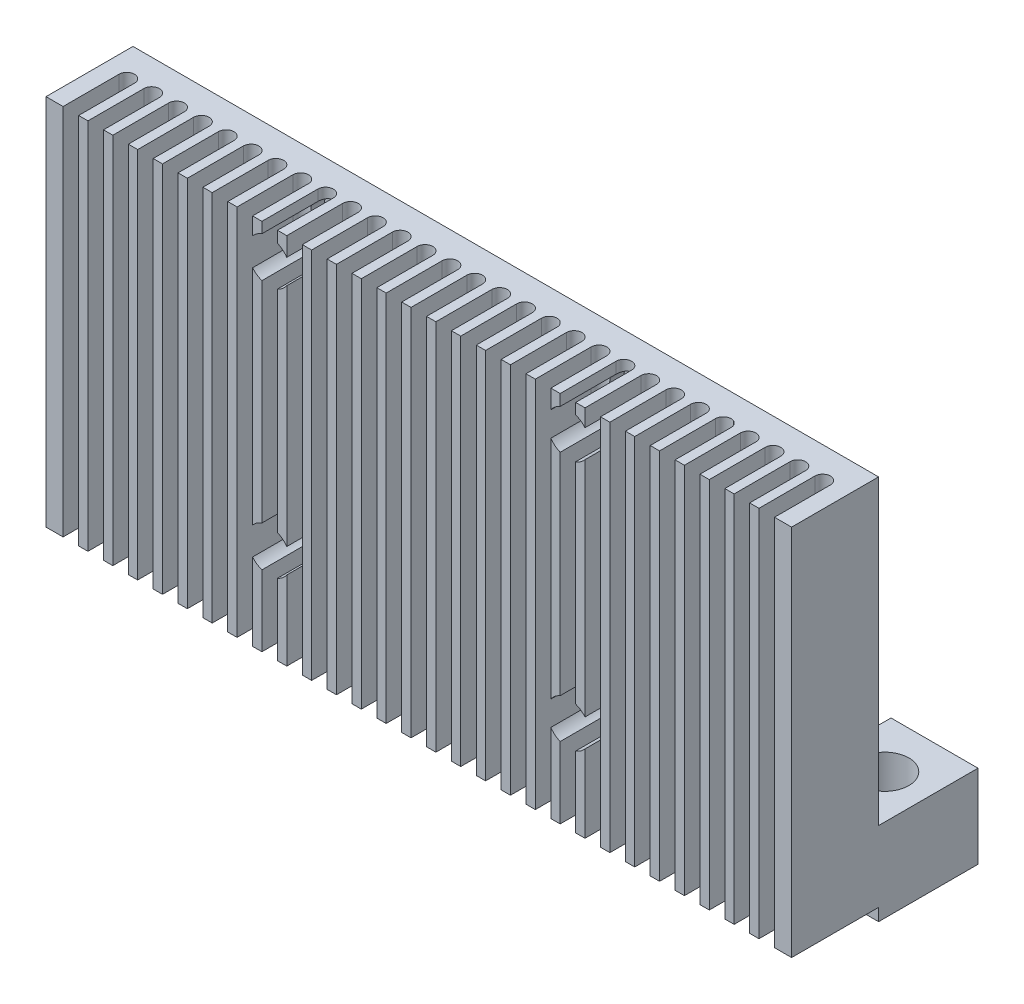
SolidWorks part; units mm, degrees
ref_plane "Front Plane" through (0, 0, 0) normal (0, 0, 1) x (1, 0, 0)
ref_plane "Top Plane" through (0, 0, 0) normal (0, 1, 0) x (1, 0, 0)
ref_plane "Right Plane" through (0, 0, 0) normal (1, 0, 0) x (0, 0, -1)
sketch "Sketch1" plane through (0, 0, 0) normal (0, 1, 0) x (1, 0, 0)
  line L3 (-38.1, 8.89) -> (38.1, 8.89)
  line L10 (-38.1, 8.89) -> (-38.1, 0)
  line L13 (0, 0) -> (0, 18.3114) construction
  line L19 (-38.1, 0) -> (38.1, 0)
  line L24 (38.1, 8.89) -> (38.1, 0)
  dimension "D5" = 8.89
  dimension "D10" = 76.2
extrude "Boss-Extrude1" add sketch "Sketch1" along normal mid plane 38.1
sketch "Sketch12" plane through (0, 0, 0) normal (0, 1, 0) x (1, 0, 0)
  line L0 (-0.7937, 0) -> (-0.7938, 5.715)
  line L1 (-0.7937, 0) -> (0.7937, 0)
  line L3 (0.7937, 0) -> (0.7937, 5.715)
  line L4 (0, 0) -> (0, -4.9066) construction
  line L5 (38.1, 8.89) -> (-38.1, 8.89) construction
  line L6 (-38.1, 0) -> (38.1, 0) construction
  arc A0 (-0.7938, 5.715) -> (0.7937, 5.715) centre (0, 5.715) cw
  dimension "D1" = 3.175
  dimension "D2" = 1.5875
extrude "Cut-Extrude1" cut sketch "Sketch12" along normal through all both and the other way through all
pattern_linear "LPattern1" count 15 spacing 2.54 along (1, 0, 0) count 15 spacing 2.54 along (-1, 0, 0) of "Cut-Extrude1"
hole_wizard "CBORE for M2 SHCS1" positions "Sketch10" profile "Sketch11" counterbore size "M2" standard "ANSI Metric"
sketch "Sketch10" plane through (0, 0, 0) normal (0, 0, 1) x (1, 0, 0)
  line L1 (-15.3, -9.725) -> (15.3, -9.725) construction
  line L2 (-15.3, -9.725) -> (-15.3, 15.875) construction
  line L3 (-15.3, 15.875) -> (15.3, 15.875) construction
  line L4 (15.3, -9.725) -> (15.3, 15.875) construction
  line L8 (0, 19.05) -> (0, 15.875) construction
  line L9 (38.1, 19.05) -> (-38.1, 19.05) construction
  point P0 (-15.3, 15.875)
  point P2 (15.3, 15.875)
  point P4 (15.3, -9.725)
  point P6 (-15.3, -9.725)
  dimension "D1" = 30.6
  dimension "D2" = 25.6
  dimension "D3" = 3.175
sketch "Sketch11" plane through (-15.3, 15.875, 0) normal (1, 0, 0) x (0, -1, 0)
  line L0 (0, 0) -> (0, 8.89)
  line L1 (0, 8.89) -> (1.3, 8.89)
  line L3 (1.3, 8.89) -> (1.3, 7.842)
  line L4 (1.3, 7.842) -> (2.2, 7.842)
  line L5 (2.2, 7.842) -> (2.2, 0)
  line L7 (2.2, 0) -> (0, 0)
  line L11 (0, -6.35) -> (0, 107.95) construction
  dimension "Thru Hole Dia." = 2.6
  dimension "Thru Hole Depth" = 8.89
  dimension "C'Bore Dia." = 4.4
  dimension "C'Bore Depth" = 7.842
sketch "Sketch14" plane through (0, -19.05, 0) normal (0, -1, 0) x (-1, 0, 0)
  line L1 (-38.1, 8.89) -> (-29.21, 8.89)
  line L2 (-38.1, 8.89) -> (-38.1, 19.05)
  line L3 (-38.1, 19.05) -> (-29.21, 19.05)
  line L4 (-29.21, 8.89) -> (-29.21, 19.05)
  line L5 (38.1, 8.89) -> (29.21, 8.89)
  line L6 (38.1, 8.89) -> (38.1, 19.05)
  line L7 (38.1, 19.05) -> (29.21, 19.05)
  line L8 (29.21, 8.89) -> (29.21, 19.05)
  line L13 (-38.1, 8.89) -> (38.1, 8.89) construction
  dimension "D2" = 10.16
  dimension "D3" = 8.89
extrude "Boss-Extrude2" add sketch "Sketch14" against normal blind 7.239 and the other way blind 1.27
sketch "Sketch13" plane through (0, 0, -8.89) normal (0, 0, -1) x (-1, 0, 0)
  line L0 (-15.3, 15.875) -> (15.3, -9.725) construction
  line L2 (-17.5, -11.925) -> (17.5, -11.925)
  line L3 (-17.5, -11.925) -> (-17.5, 18.075)
  line L4 (-17.5, 18.075) -> (17.5, 18.075)
  line L5 (17.5, -11.925) -> (17.5, 18.075)
  line L6 (-17.5, -11.925) -> (17.5, 18.075) construction
  line L7 (-17.5, 18.075) -> (17.5, -11.925) construction
  circle A0 centre (15.3, -9.725) radius 1.3 construction
  point P6 (0, 3.075)
  dimension "D1" = 35
  dimension "D2" = 30
hole_wizard "#10 (0.1935) Diameter Hole1" positions "Sketch15" profile "Sketch16" hole size "#10" standard "ANSI Inch"
sketch "Sketch15" plane through (0, -11.811, 0) normal (0, 1, 0) x (1, 0, 0)
  line L0 (29.21, 8.89) -> (38.1, 19.05) construction
  line L1 (-38.1, 8.89) -> (-29.21, 19.05) construction
  point P0 (33.655, 13.97)
  point P2 (-33.655, 13.97)
sketch "Sketch16" plane through (33.655, -11.811, -13.97) normal (1, 0, 0) x (0, 0, 1)
  line L0 (0, 0) -> (0, 8.509)
  line L1 (0, 8.509) -> (2.4574, 8.509)
  line L2 (2.4574, 8.509) -> (2.4574, 0)
  line L5 (2.4574, 0) -> (0, 0)
  line L11 (0, -6.35) -> (0, 107.95) construction
  dimension "Thru Hole Dia." = 4.9149
  dimension "Thru Hole Depth" = 8.509
